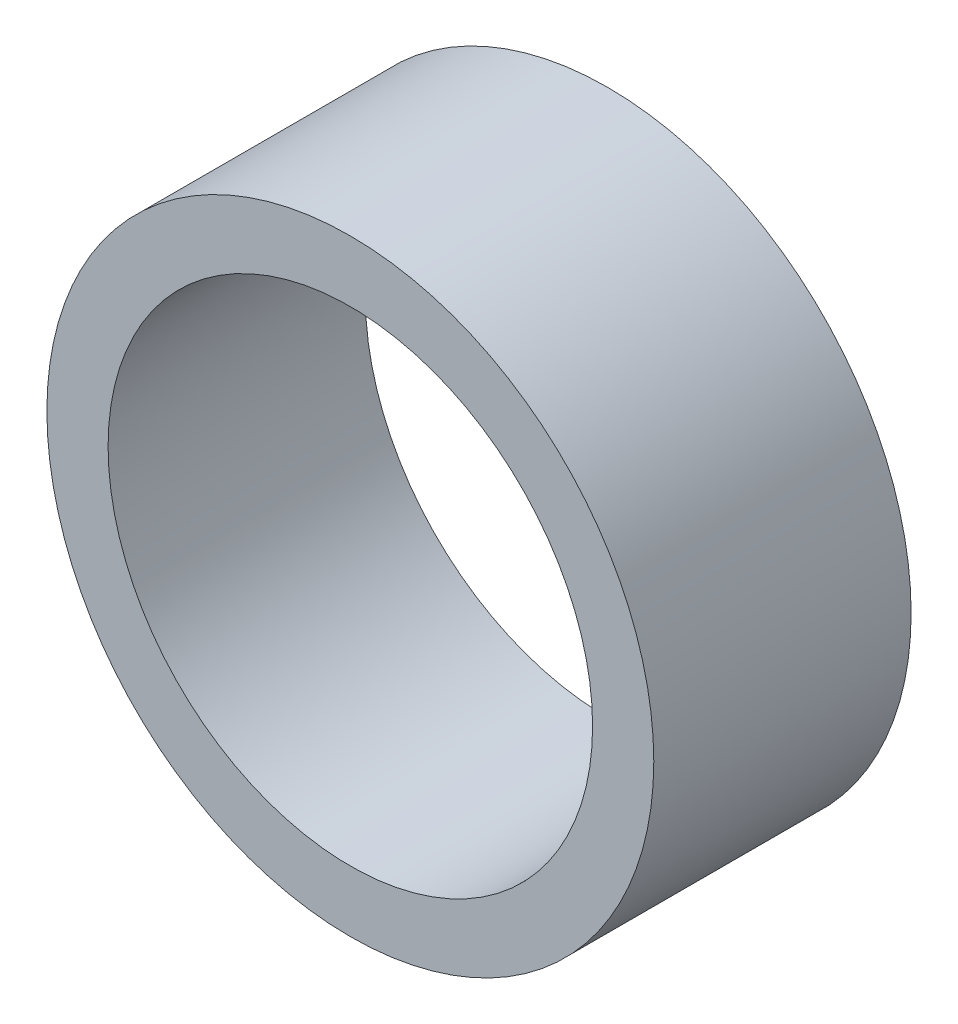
SolidWorks part; units mm, degrees
ref_plane "Front" through (0, 0, 0) normal (0, 0, 1) x (1, 0, 0)
ref_plane "Top" through (0, 0, 0) normal (0, 1, 0) x (1, 0, 0)
ref_plane "Right" through (0, 0, 0) normal (1, 0, 0) x (0, 0, -1)
sketch "Sketch1" plane through (0, 0, 0) normal (0, 0, 1) x (1, 0, 0)
  line L0 (0, 0) -> (1.1684, 0) construction
  circle A0 centre (1.1684, 0) radius 6.1404
  dimension "D2" = 1.1684
  dimension "D1" = 12.2809
extrude "Extrude1" add sketch "Sketch1" along normal blind 5.207
sketch "Sketch5" plane through (0, 0, 0) normal (0, 0, -1) x (-1, 0, 0)
  circle A0 centre (-1.1684, 0) radius 4.9022
  circle A3 centre (-1.1684, 0) radius 6.1405 construction
  dimension "D1" = 9.8044
extrude "Cut-Extrude3" cut sketch "Sketch5" against normal through all
